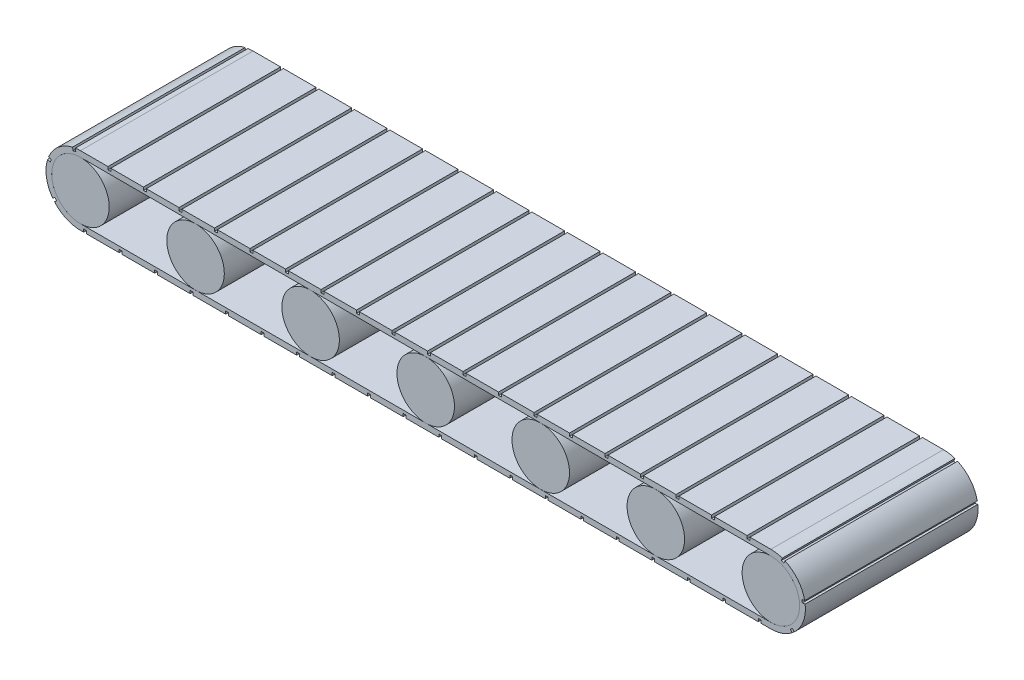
SolidWorks part; units mm, degrees
ref_plane "Front Plane" through (0, 0, 0) normal (0, 0, 1) x (1, 0, 0)
ref_plane "Top Plane" through (0, 0, 0) normal (0, 1, 0) x (1, 0, 0)
ref_plane "Right Plane" through (0, 0, 0) normal (1, 0, 0) x (0, 0, -1)
sketch "Sketch1" plane through (0, 0, 0) normal (0, 0, 1) x (1, 0, 0)
  circle A0 centre (0, 0) radius 50
  circle A1 centre (200, 0) radius 50
  circle A2 centre (400, 0) radius 50
  circle A3 centre (600, 0) radius 50
  circle A4 centre (800, 0) radius 50
  circle A5 centre (1000, 0) radius 50
  circle A6 centre (1200, 0) radius 50
  dimension "D1" = 100
extrude "Extrude1" add sketch "Sketch1" along normal blind 300
sketch "Sketch2" plane through (0, 0, 0) normal (0, 0, 1) x (1, 0, 0)
  line L0 (0, 50) -> (1200, 50)
  line L1 (0, -50) -> (1200, -50)
  circle A0 centre (0, 0) radius 50 construction
  arc A1 (0, 50) -> (0, -50) centre (0, 0) ccw
  circle A2 centre (1200, 0) radius 50 construction
  arc A3 (1200, -50) -> (1200, 50) centre (1200, 0) ccw
extrude "Extrude-Thin1" add sketch "Sketch2" along normal up to surface (300 mm away) separate body thin
curve "CompCurve1"
sketch "Sketch3" plane through (0, 0, 300) normal (0, 0, 1) x (1, 0, 0)
  line L0 (1200, 60) -> (0, 60) construction
  line L1 (47.7449, 60) -> (52.7449, 60)
  line L2 (47.7449, 60) -> (47.7449, 55)
  line L3 (47.7449, 55) -> (52.7449, 55)
  line L4 (52.7449, 60) -> (52.7449, 55)
  dimension "D1" = 5
  dimension "D2" = 5
extrude "Cut-Extrude1" cut sketch "Sketch3" against normal through all
pattern_curve "CrvPattern1" of "Cut-Extrude1" parameters "D1"=45, "D3"=10, "D2"=1, "D4"=10
sketch "Sketch4" plane through (0, 0, 0) normal (0, 0, 1) x (1, 0, 0)
  point P0 (-120, 0)
  point P1 (1320, 0)
  point P3 (1200, 0)
  dimension "D1" = 120
  dimension "D2" = 120
